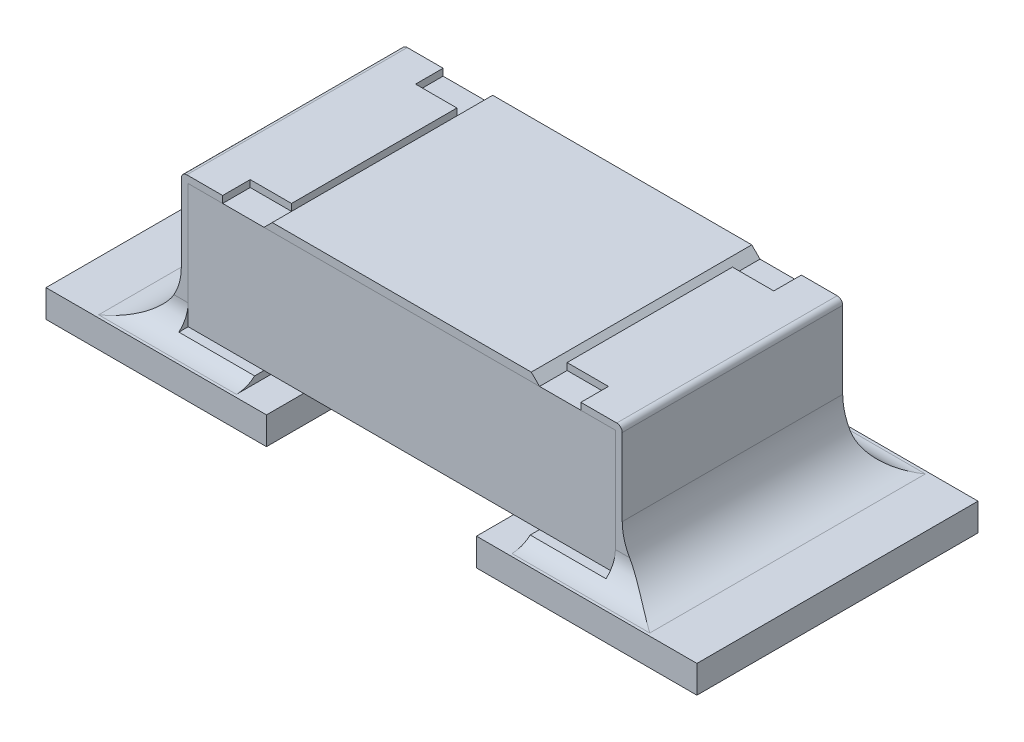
SolidWorks part; units mm, degrees
ref_plane "Front Plane" through (0, 0, 0) normal (0, 0, 1) x (1, 0, 0)
ref_plane "Top Plane" through (0, 0, 0) normal (0, 1, 0) x (1, 0, 0)
ref_plane "Right Plane" through (0, 0, 0) normal (1, 0, 0) x (0, 0, -1)
sketch "Sketch1" plane through (0, 0, 0) normal (1, 0, 0) x (0, 0, -1)
  line L0 (0, 55) -> (0, -55) construction
  line L1 (-0.4, 0.575) -> (0.4, 0.575)
  line L2 (-0.4, 0.575) -> (-0.4, 0.125)
  line L3 (-0.4, 0.125) -> (0.4, 0.125)
  line L4 (0.4, 0.575) -> (0.4, 0.125)
  line L5 (55, 0) -> (-55, 0) construction
  dimension "D1" = 0.8
  dimension "D2" = 0.4
  dimension "D3" = 0.45
  dimension "D4" = 0.125
extrude "Boss-Extrude1" add sketch "Sketch1" along normal mid plane 1.55
sketch "Sketch2" plane through (0, 0, 0) normal (0, 0, 1) x (1, 0, 0)
  line L0 (-0.5, 0.6) -> (-0.78, 0.6)
  line L1 (-0.8, 0.58) -> (-0.8, 0.1)
  line L2 (-0.8, 0.1) -> (-0.5, 0.1)
  line L3 (-0.5, 0.1) -> (-0.5, 0.125)
  line L4 (0.775, 0.125) -> (-0.775, 0.125) construction
  line L5 (-0.5, 0.125) -> (-0.775, 0.125)
  line L6 (-0.775, 0.125) -> (-0.775, 0.575)
  line L7 (-0.775, 0.575) -> (-0.5, 0.575)
  line L8 (0.775, 0.575) -> (-0.775, 0.575) construction
  line L9 (-0.5, 0.575) -> (-0.5, 0.6)
  line L11 (0.5, 0.575) -> (0.5, 0.6)
  line L12 (0.5, 0.6) -> (0.78, 0.6)
  line L13 (0.8, 0.58) -> (0.8, 0.1)
  line L14 (0.8, 0.1) -> (0.5, 0.1)
  line L15 (0.5, 0.1) -> (0.5, 0.125)
  line L16 (0.5, 0.125) -> (0.775, 0.125)
  line L17 (0.775, 0.125) -> (0.775, 0.575)
  line L18 (0.775, 0.575) -> (0.5, 0.575)
  arc A0 (0.78, 0.6) -> (0.8, 0.58) centre (0.78, 0.58) cw
  arc A1 (-0.78, 0.6) -> (-0.8, 0.58) centre (-0.78, 0.58) ccw
  point P28 (-0.8, 0.6)
  dimension "D6" = 0.02
  dimension "D1" = 0.025
  dimension "D2" = 0.025
  dimension "D3" = 0.025
  dimension "D4" = 0.3
  dimension "D5" = 0.3
extrude "Boss-Extrude2" add sketch "Sketch2" along normal mid plane 0.8 separate body
sketch "Sketch3" plane through (0, 0.6, 0) normal (0, 1, 0) x (1, 0, 0)
  line L0 (0.5, -0.4) -> (0.5, 0.4) construction
  line L1 (-0.5, 0.4) -> (-0.65, 0.4)
  line L2 (-0.5, 0.4) -> (-0.5, 0.3)
  line L3 (-0.5, 0.3) -> (-0.65, 0.3)
  line L4 (-0.65, 0.4) -> (-0.65, 0.3)
  line L5 (-0.5, -0.4) -> (-0.65, -0.4)
  line L6 (-0.5, -0.4) -> (-0.5, -0.3)
  line L7 (-0.5, -0.3) -> (-0.65, -0.3)
  line L8 (-0.65, -0.4) -> (-0.65, -0.3)
  line L9 (0.5, -0.4) -> (0.65, -0.4)
  line L10 (0.5, -0.4) -> (0.5, -0.3)
  line L11 (0.5, -0.3) -> (0.65, -0.3)
  line L12 (0.65, -0.4) -> (0.65, -0.3)
  line L13 (0.775, -0.4) -> (-0.775, -0.4) construction
  line L15 (0.5, 0.4) -> (0.65, 0.4)
  line L16 (0.5, 0.4) -> (0.5, 0.3)
  line L17 (0.5, 0.3) -> (0.65, 0.3)
  line L18 (0.65, 0.4) -> (0.65, 0.3)
  dimension "D1" = 0.15
  dimension "D2" = 0.1
extrude "Cut-Extrude1" cut sketch "Sketch3" against normal blind 0.025
sketch "Sketch4" plane through (0, 0, 0) normal (0, 0, 1) x (1, 0, 0)
  line L0 (-0.5, 0.575) -> (0.5, 0.575)
  line L1 (0.5, 0.575) -> (0.47, 0.605)
  line L2 (0.47, 0.605) -> (-0.47, 0.605)
  line L3 (-0.47, 0.605) -> (-0.5, 0.575)
  dimension "D1" = 45
  dimension "D2" = 45
  dimension "D3" = 0.03
extrude "Boss-Extrude3" add sketch "Sketch4" along normal mid plane 0.8 separate body
sketch "Sketch7" plane through (0, 0, 0) normal (0, 1, 0) x (1, 0, 0)
  line L0 (0, -0.2833) -> (0, 0.2833) construction
  line L1 (-0.381, -0.51) -> (-1.181, -0.51)
  line L2 (-0.381, -0.51) -> (-0.381, 0.51)
  line L3 (-0.381, 0.51) -> (-1.181, 0.51)
  line L4 (-1.181, -0.51) -> (-1.181, 0.51)
  line L5 (0.381, -0.51) -> (1.181, -0.51)
  line L6 (0.381, -0.51) -> (0.381, 0.51)
  line L7 (0.381, 0.51) -> (1.181, 0.51)
  line L8 (1.181, -0.51) -> (1.181, 0.51)
  line L9 (-0.2833, 0) -> (0.2833, 0) construction
  dimension "D1" = 0.8
  dimension "D2" = 0.381
  dimension "D3" = 0.381
  dimension "D4" = 1.02
  dimension "D5" = 0.51
extrude "Boss-Extrude5" add sketch "Sketch7" along normal blind 0.1
fillet "Fillet3" radius 0.2 1 edges at (-0.8, 0.1, 0)
fillet "Fillet4" radius 0.2 1 edges at (0.8, 0.1, 0)
fillet "Fillet5" radius 0.1 2 edges at (0.75, 0.1, -0.4) (0.75, 0.1, 0.4)
fillet "Fillet6" radius 0.1 2 edges at (-0.75, 0.1, 0.4) (-0.75, 0.1, -0.4)
